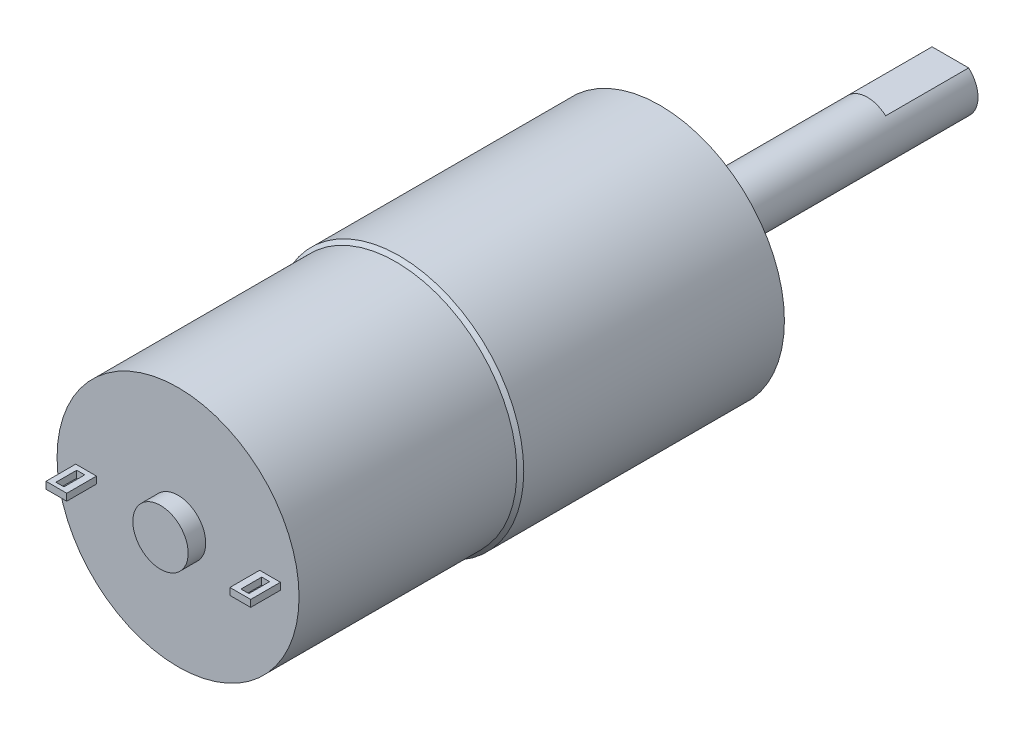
SolidWorks part; units mm, degrees
ref_plane "Front Plane" through (0, 0, 0) normal (0, 0, 1) x (1, 0, 0)
ref_plane "Top Plane" through (0, 0, 0) normal (0, 1, 0) x (1, 0, 0)
ref_plane "Right Plane" through (0, 0, 0) normal (1, 0, 0) x (0, 0, -1)
sketch "Sketch1" plane through (0, 0, 0) normal (0, 0, 1) x (1, 0, 0)
  circle A0 centre (0, 0) radius 18
  dimension "D1" = 36
extrude "Boss-Extrude1" add sketch "Sketch1" along normal blind 38.7
sketch "Sketch2" plane through (0, 0, 38.7) normal (0, 0, 1) x (1, 0, 0)
  circle A0 centre (0, 0) radius 17.5
  dimension "D1" = 35
extrude "Boss-Extrude2" add sketch "Sketch2" along normal blind 31
chamfer "Chamfer1" distance 1 angle 45 1 edges at (18, 0, 38.7)
sketch "Sketch3" plane through (0, 0, 0) normal (0, 0, -1) x (-1, 0, 0)
  circle A0 centre (0, 0) radius 11
  dimension "D1" = 22
extrude "Boss-Extrude3" add sketch "Sketch3" along normal blind 2
sketch "Sketch4" plane through (0, 0, -2) normal (0, 0, -1) x (-1, 0, 0)
  circle A0 centre (0, 0) radius 4
  dimension "D1" = 8
extrude "Boss-Extrude4" add sketch "Sketch4" along normal blind 40
sketch "Sketch5" plane through (0, 0, -42) normal (0, 0, -1) x (-1, 0, 0)
  line L0 (0, 3) -> (0, 4)
  line L1 (-2.6458, 3) -> (2.6458, 3)
  circle A0 centre (0, 0) radius 4 construction
  arc A1 (2.6458, 3) -> (-2.6458, 3) centre (0, 0) ccw
  dimension "D1" = 1
extrude "Cut-Extrude1" cut sketch "Sketch5" against normal blind 12 contours L1 A1
sketch "Sketch6" plane through (0, 0, 69.7) normal (0, 0, 1) x (1, 0, 0)
  circle A0 centre (0, 0) radius 4
  dimension "D1" = 8
extrude "Boss-Extrude5" add sketch "Sketch6" along normal blind 2.54
sketch "Sketch7" plane through (0, 0, 69.7) normal (0, 0, 1) x (1, 0, 0)
  line L0 (-17.5, 0) -> (17.5, 0)
  line L2 (11.8, 0.5) -> (14.8, 0.5)
  line L3 (11.8, 0.5) -> (11.8, -0.5)
  line L4 (11.8, -0.5) -> (14.8, -0.5)
  line L5 (14.8, 0.5) -> (14.8, -0.5)
  line L6 (11.8, 0.5) -> (14.8, -0.5) construction
  line L7 (11.8, -0.5) -> (14.8, 0.5) construction
  line L8 (-14.8, 0.5) -> (-11.8, 0.5)
  line L9 (-14.8, 0.5) -> (-14.8, -0.5)
  line L10 (-14.8, -0.5) -> (-11.8, -0.5)
  line L11 (-11.8, 0.5) -> (-11.8, -0.5)
  line L12 (-14.8, 0.5) -> (-11.8, -0.5) construction
  line L13 (-14.8, -0.5) -> (-11.8, 0.5) construction
  circle A0 centre (0, 0) radius 17.5 construction
  circle A1 centre (0, 0) radius 17.5 construction
  point P7 (13.3, 0)
  point P12 (-13.3, 0)
  dimension "D1" = 3
  dimension "D2" = 3
  dimension "D3" = 2.7
  dimension "D4" = 2.7
  dimension "D5" = 1
  dimension "D6" = 1
extrude "Boss-Extrude6" add sketch "Sketch7" along normal blind 4.3 contours L4 L5 L2 L3 | L8 L11 L10 L9
sketch "Sketch8" plane through (0, 0.5, 0) normal (0, 1, 0) x (1, 0, 0)
  line L0 (-14.8, -74) -> (-11.8, -74) construction
  line L1 (12.8, -73.4) -> (13.9429, -73.4)
  line L2 (12.8, -73.4) -> (12.8, -70.4)
  line L3 (12.8, -70.4) -> (13.9429, -70.4)
  line L4 (13.9429, -73.4) -> (13.9429, -70.4)
  line L5 (12.8, -73.4) -> (13.9429, -70.4) construction
  line L6 (12.8, -70.4) -> (13.9429, -73.4) construction
  line L7 (-13.9628, -70.4) -> (-12.8, -70.4)
  line L8 (-13.9628, -70.4) -> (-13.9628, -73.4)
  line L9 (-13.9628, -73.4) -> (-12.8, -73.4)
  line L10 (-12.8, -70.4) -> (-12.8, -73.4)
  line L11 (-13.9628, -70.4) -> (-12.8, -73.4) construction
  line L12 (-13.9628, -73.4) -> (-12.8, -70.4) construction
  line L13 (11.8, -74) -> (14.8, -74) construction
  line L14 (11.8, -74) -> (11.8, -69.7) construction
  line L15 (-11.8, -74) -> (-11.8, -69.7) construction
  point P0 (13.3714, -71.9)
  point P5 (-13.3814, -71.9)
  dimension "D1" = 0.6
  dimension "D2" = 0.6
  dimension "D3" = 1
  dimension "D4" = 1
  dimension "D5" = 3
  dimension "D6" = 3
extrude "Cut-Extrude2" cut sketch "Sketch8" against normal blind 4.3
